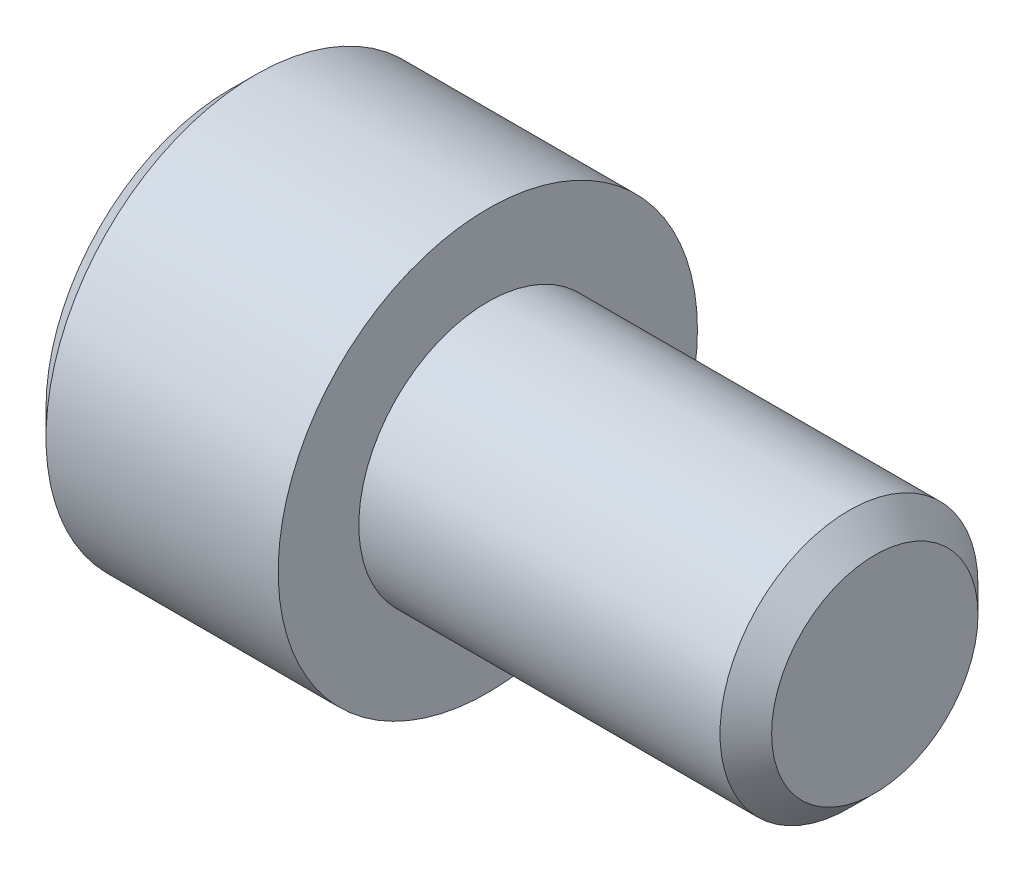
SolidWorks part; units mm, degrees
ref_plane "Front" through (0, 0, 0) normal (0, 0, 1) x (1, 0, 0)
ref_plane "Top" through (0, 0, 0) normal (0, 1, 0) x (1, 0, 0)
ref_plane "Right" through (0, 0, 0) normal (1, 0, 0) x (0, 0, -1)
sketch "Sketch1" plane through (0, 0, 0) normal (0, 0, 1) x (1, 0, 0)
  line L0 (0, 0) -> (0, 5.7)
  line L1 (0.8, 6.5) -> (8, 6.5)
  line L2 (8, 6.5) -> (8, 4)
  line L3 (8, 4) -> (19.2, 4)
  line L4 (20, 3.2) -> (20, 0)
  line L5 (20, 0) -> (0, 0)
  line L6 (20, 0) -> (-7.1815, 0) construction
  line L7 (0, 5.7) -> (0.8, 6.5)
  line L8 (19.2, 4) -> (20, 3.2)
  point P1 (0, 6.5)
  point P6 (20, 4)
  point P10 (0, 0)
  dimension "D1" = 13
  dimension "D2" = 12
  dimension "D3" = 8
  dimension "D4" = 8
  dimension "D5" = 0.8
  dimension "D6" = 45
  dimension "D7" = 0.8
  dimension "D8" = 45
revolve "Revolve1" add sketch "Sketch1" angle 360 about L6
